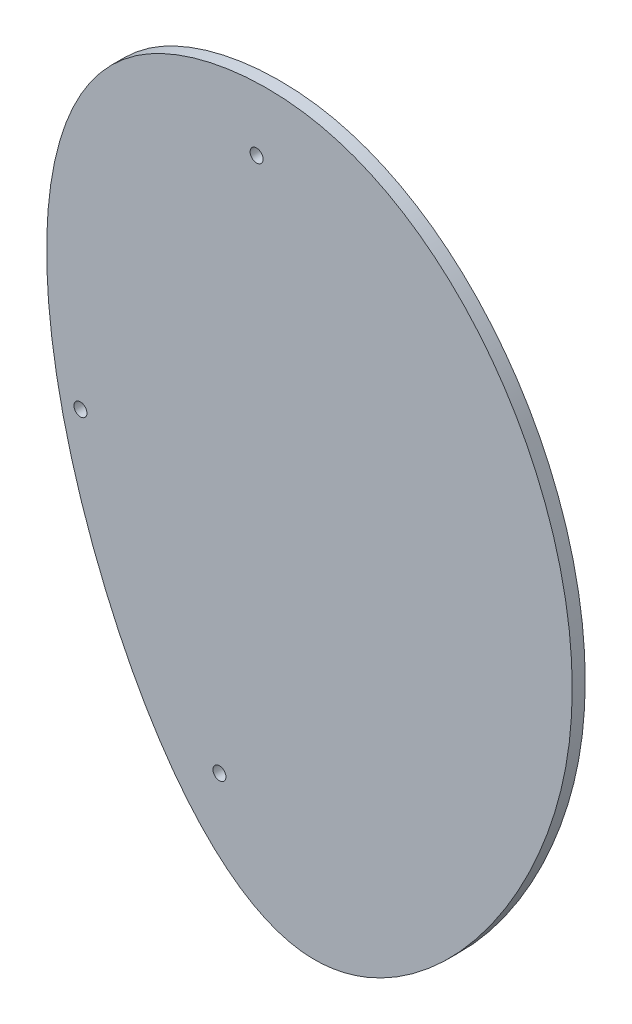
SolidWorks part; units mm, degrees
ref_plane "Front Plane" through (0, 0, 0) normal (0, 0, 1) x (1, 0, 0)
ref_plane "Top Plane" through (0, 0, 0) normal (0, 1, 0) x (1, 0, 0)
ref_plane "Right Plane" through (0, 0, 0) normal (1, 0, 0) x (0, 0, -1)
sketch "Sketch1" plane through (0, 0, 0) normal (0, 0, 1) x (1, 0, 0)
  line L0 (0, 0) -> (0, 177.8) construction
  circle A0 centre (-11.6074, 162.9623) radius 1.5875
  circle A1 centre (-20.6862, 27.7185) radius 1.5875
  circle A2 centre (-54.6474, 87.726) radius 1.5875
  spline S0 degree 3 poles (96.584, 80.219) (32.781, 187.8985) (-71.3532, 169.6507) (-65.7975, 65.9003) (2.5194, -30.2221) (96.584, 80.219) (32.781, 187.8985) (-71.3532, 169.6507) knots -0.653533 -0.489069 -0.27686 0 0.08778 0.346467 0.510931 0.72314 1 1.08778 1.346467 1.510931 only from (0, 177.8) to (0, 177.8)
  dimension "D2" = 3.175
  dimension "D1" = 177.8
extrude "Boss-Extrude1" add sketch "Sketch1" along normal blind 3.175
